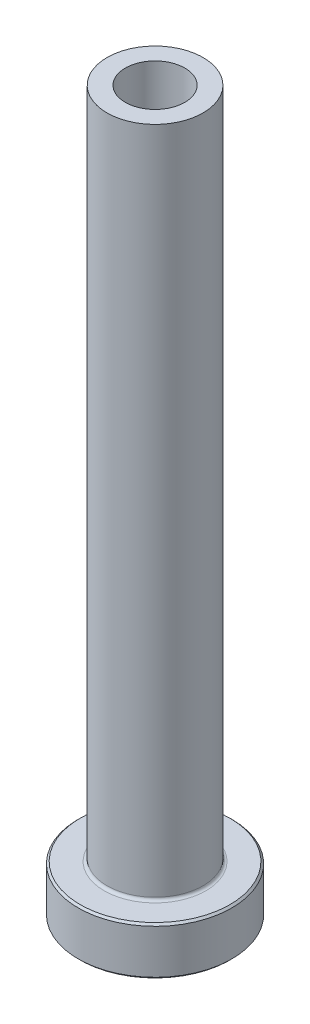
SolidWorks part; units mm, degrees
ref_plane "Front Plane" through (0, 0, 0) normal (0, 0, 1) x (1, 0, 0)
ref_plane "Top Plane" through (0, 0, 0) normal (0, 1, 0) x (1, 0, 0)
ref_plane "Right Plane" through (0, 0, 0) normal (1, 0, 0) x (0, 0, -1)
sketch "Sketch1" plane through (0, 0, 0) normal (0, 0, 1) x (1, 0, 0)
  line L0 (-3.1, 75) -> (-5, 75)
  line L1 (-5, 75) -> (-5, 5)
  line L2 (-5, 5) -> (-8, 5)
  line L3 (-8, 5) -> (-8, 0)
  line L4 (8.8, 0) -> (-8.8, 0) construction
  line L5 (-8, 0) -> (-3.35, 0)
  line L6 (-3.1, 30) -> (-3.1, 75)
  line L7 (0, 92.1877) -> (0, -15.5353) construction
  line L8 (0, -8.8) -> (0, 8.8) construction
  line L9 (-3.1, 30) -> (-3.35, 18)
  line L10 (-3.35, 18) -> (-3.35, 0)
  dimension "D1" = 0.25
  dimension "ID" = 6.2
  dimension "OD" = 10
  dimension "L" = 75
  dimension "H" = 16
  dimension "T" = 5
  dimension "N" = 45
  dimension "D2" = 12
revolve "Revolve1" add sketch "Sketch1" angle 360 about L7
fillet "Fillet1" radius 0.3 1 edges at (0, 5, 5)
chamfer "Chamfer1" distance 0.2 angle 45 2 edges at (0, 5, 8) (0, 0, 8)
chamfer "Chamfer3" distance 0.5 angle 45 1 edges at (0, 0, 3.35)
